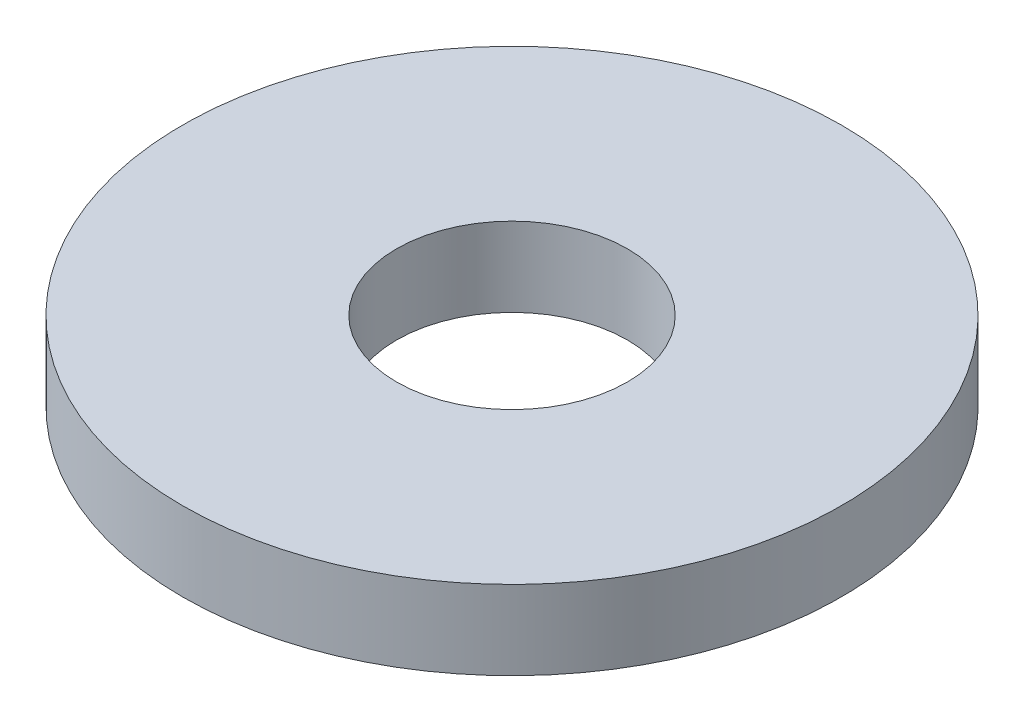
SolidWorks part; units mm, degrees
ref_plane "Front Plane" through (0, 0, 0) normal (0, 0, 1) x (1, 0, 0)
ref_plane "Top Plane" through (0, 0, 0) normal (0, 1, 0) x (1, 0, 0)
ref_plane "Right Plane" through (0, 0, 0) normal (1, 0, 0) x (0, 0, -1)
sketch "Sketch1" plane through (0, 0, 0) normal (0, 1, 0) x (1, 0, 0)
  circle A0 centre (0, 0) radius 1.7526
  circle A1 centre (0, 0) radius 5.0038
  dimension "D1" = 10.0076
  dimension "D2" = 3.5052
extrude "Boss-Extrude1" add sketch "Sketch1" along normal blind 1.2
